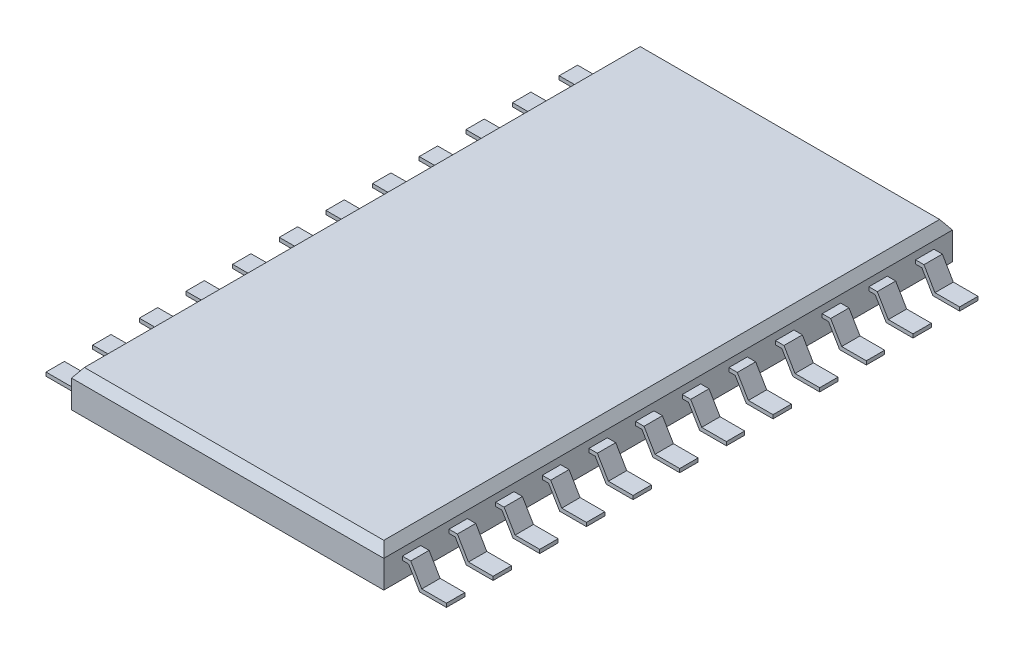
SolidWorks part; units mm, degrees
ref_plane "Front Plane" through (0, 0, 0) normal (0, 0, 1) x (1, 0, 0)
ref_plane "Top Plane" through (0, 0, 0) normal (0, 1, 0) x (1, 0, 0)
ref_plane "Right Plane" through (0, 0, 0) normal (1, 0, 0) x (0, 0, -1)
sketch "Sketch1" plane through (0, 0, 0) normal (0, 1, 0) x (1, 0, 0)
  line L0 (0, 6.8835) -> (0, -6.8835) construction
  line L1 (-5.5575, 0) -> (5.5575, 0) construction
  line L3 (-4.25, 8.375) -> (4.25, 8.375)
  line L4 (-4.25, 8.375) -> (-4.25, -8.375)
  line L5 (-4.25, -8.375) -> (4.25, -8.375)
  line L6 (4.25, 8.375) -> (4.25, -8.375)
  dimension "D1" = 8.5
  dimension "D2" = 16.75
extrude "Extrude1" add sketch "Sketch1" along normal mid plane 1
chamfer "Chamfer1" distance 0.25 angle 35 4 edges at (0, 0.5, -8.375) (4.25, 0.5, 0) (0, 0.5, 8.375) (-4.25, 0.5, 0)
sketch "Sketch4" plane through (0, 0, 0) normal (0, 0, 1) x (1, 0, 0)
  line L0 (0, 1.2724) -> (0, -0.9364) construction
  line L1 (-4.25, 1.8525) -> (-4.25, -1.3157) construction
  line L2 (-4.25, 0.25) -> (-4.25, -0.5) construction
  line L3 (0, 0) -> (-6.2695, 0) construction
  line L4 (-5.45, 1.2724) -> (-5.45, -1.1019) construction
  line L5 (-4.25, 0) -> (-4.45, 0)
  line L6 (-4.45, 0) -> (-4.75, -0.51)
  line L7 (-4.75, -0.51) -> (-5.45, -0.51)
  line L9 (-4.25, -0.5) -> (4.25, -0.5) construction
  point P19 (-4.45, 0)
  point P22 (-4.75, -0.51)
  dimension "D1" = 1.2
  dimension "D2" = 0.01
  dimension "D3" = 0.7
  dimension "D4" = 0.2
extrude "Extrude-Thin1" add sketch "Sketch4" along normal mid plane 0.5 thin
pattern_linear "LPattern1" count 7 spacing 1.27 along (0, 0, -1) count 6 spacing 1.27 along (0, 0, 1) of "Extrude-Thin1"
mirror "Mirror1" about plane through (0, 0, 0) normal (1, 0, 0) of "LPattern1", "Extrude-Thin1"
other "Move Face1" parameters "D1"=1.27
